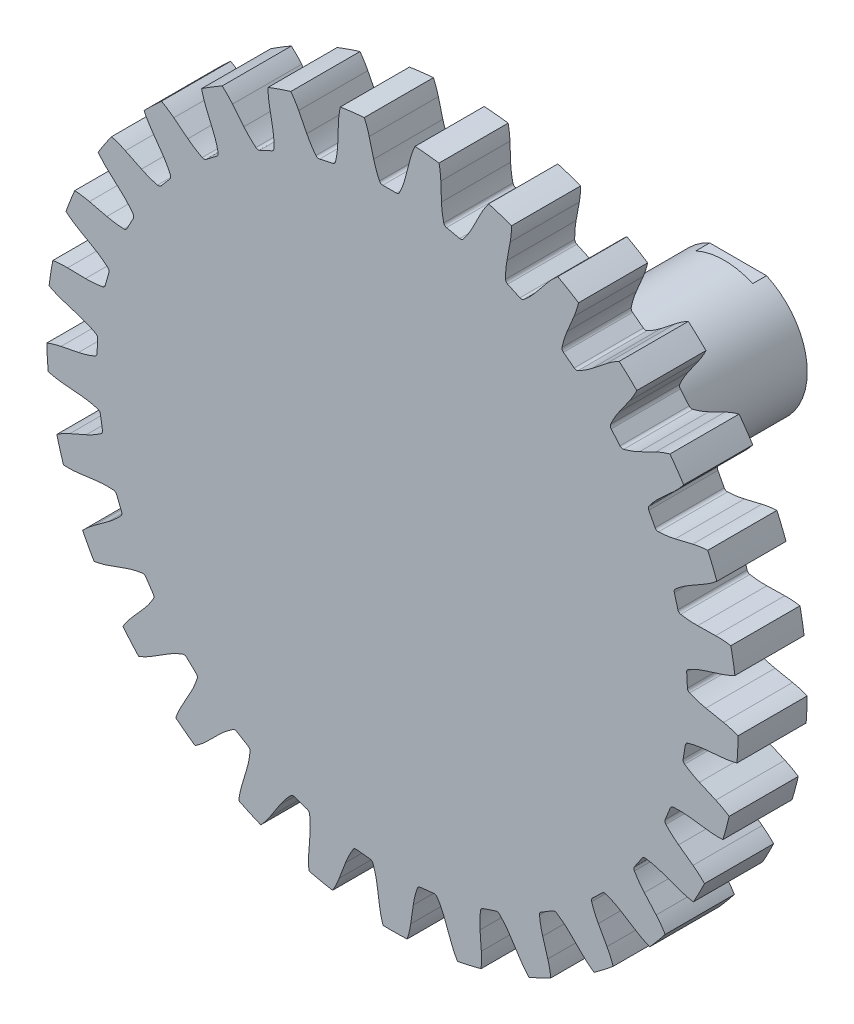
SolidWorks part; units mm, degrees
ref_plane "Front" through (0, 0, 0) normal (0, 0, 1) x (1, 0, 0)
ref_plane "Top" through (0, 0, 0) normal (0, 1, 0) x (1, 0, 0)
ref_plane "Right" through (0, 0, 0) normal (1, 0, 0) x (0, 0, -1)
sketch "Sketch1" plane through (0, 0, 0) normal (0, 0, 1) x (1, 0, 0)
  line L0 (0, 0) -> (0, 63.5) construction
  circle A1 centre (0, 0) radius 63.5
  dimension "D1" = 127
extrude "Extrude1" add sketch "Sketch1" along normal blind 12.7
sketch "Sketch2" [suppressed] plane through (0, 0, 12.7) normal (0, 0, 1) x (1, 0, 0)
  line L0 (0, 0) -> (0, 31.75) construction
  line L1 (3.7322, 29.8519) -> (3.81, 30.3599)
  line L2 (-3.7322, 29.8519) -> (-3.81, 30.3599)
  circle A0 centre (0, 0) radius 63.5 construction
  arc A1 (1.905, 24.0099) -> (-1.905, 24.0099) centre (0, 0) ccw
  arc A2 (1.905, 24.0099) -> (3.7322, 29.8519) centre (-16.3537, 32.9275) ccw
  arc A3 (3.81, 30.3599) -> (4.0769, 31.4872) centre (10.922, 29.2709) cw
  arc A4 (-3.81, 30.3599) -> (-4.0769, 31.4872) centre (-10.922, 29.2709) ccw
  arc A5 (-1.905, 24.0099) -> (-3.7322, 29.8519) centre (16.3537, 32.9275) cw
  dimension "D1" = 7.62
  dimension "D2" = 20.32
  dimension "D4" = 6.35
  dimension "D5" = 3.81
  dimension "D3" = 0.508
extrude "Cut-Extrude1" [suppressed] cut sketch "Sketch2" against normal through all and the other way through all flip side to cut
fillet "Fillet1" [suppressed] radius 0.635
pattern_circular "CirPattern1" [suppressed] count 31 over 360
pattern_circular "CirPattern2" [suppressed] count 16 over 360
sketch "Sketch3" plane through (0, 0, 0) normal (0, 0, -1) x (-1, 0, 0)
  circle A0 centre (0, 0) radius 12.7
  dimension "D1" = 25.4
extrude "Extrude2" add sketch "Sketch3" along normal blind 50.8
sketch "Sketch4" plane through (-0.5363, -17.3542, 12.7) normal (0, 0, 1) x (1, 0, 0)
  line L2 (-1.2213, 71.5867) -> (1.2586, 71.5867)
  line L5 (2.9317, 74.8923) -> (3.7553, 78.077)
  line L7 (-2.8944, 74.8923) -> (-3.718, 78.077)
  line L11 (6.5556, 74.8351) -> (0.4659, 74.8351) construction
  line L14 (0.6035, 77.7923) -> (7.0068, 77.7923) construction
  circle A0 centre (0.5363, 17.3542) radius 63.5 construction
  arc A3 (4.6939, 80.718) -> (3.7553, 78.077) centre (19.1247, 74.1022) ccw
  arc A4 (1.8571, 71.9622) -> (2.9317, 74.8923) centre (-12.4376, 78.8671) ccw
  arc A7 (1.2586, 71.5867) -> (1.8571, 71.9622) centre (1.2586, 72.2513) ccw
  arc A8 (-1.2213, 71.5867) -> (-1.8197, 71.9622) centre (-1.2213, 72.2513) cw
  arc A9 (-1.8197, 71.9622) -> (-2.8944, 74.8923) centre (12.475, 78.8671) cw
  arc A10 (-4.6566, 80.718) -> (-3.718, 78.077) centre (-19.0873, 74.1022) cw
  point P2 (0.0187, 80.718)
  point P7 (3.3435, 76.4847)
  point P9 (-3.3249, 76.2)
  point P13 (0, 76.2)
  point P50 (0.0187, 71.5867)
  dimension "D5" = 0.6646
  dimension "D2" = 15.875
extrude "Cut-Extrude2" cut sketch "Sketch4" against normal through all flip side to cut
pattern_circular "CirPattern3" count 29 over 360 about axis through (0, 0, 0) along (0, 0, 1) of "Cut-Extrude2"
sketch "Sketch5" plane through (0, 0, -50.8) normal (0, 0, -1) x (-1, 0, 0)
  line L0 (-5.2169, 11.579) -> (5.2169, 11.579)
  circle A0 centre (0, 0) radius 12.7 construction
  circle A1 centre (0, 0) radius 12.7 construction
  arc A2 (-5.2169, 11.579) -> (5.2169, 11.579) centre (0, 0) cw
extrude "Cut-Extrude3" cut sketch "Sketch5" against normal blind 2.54
